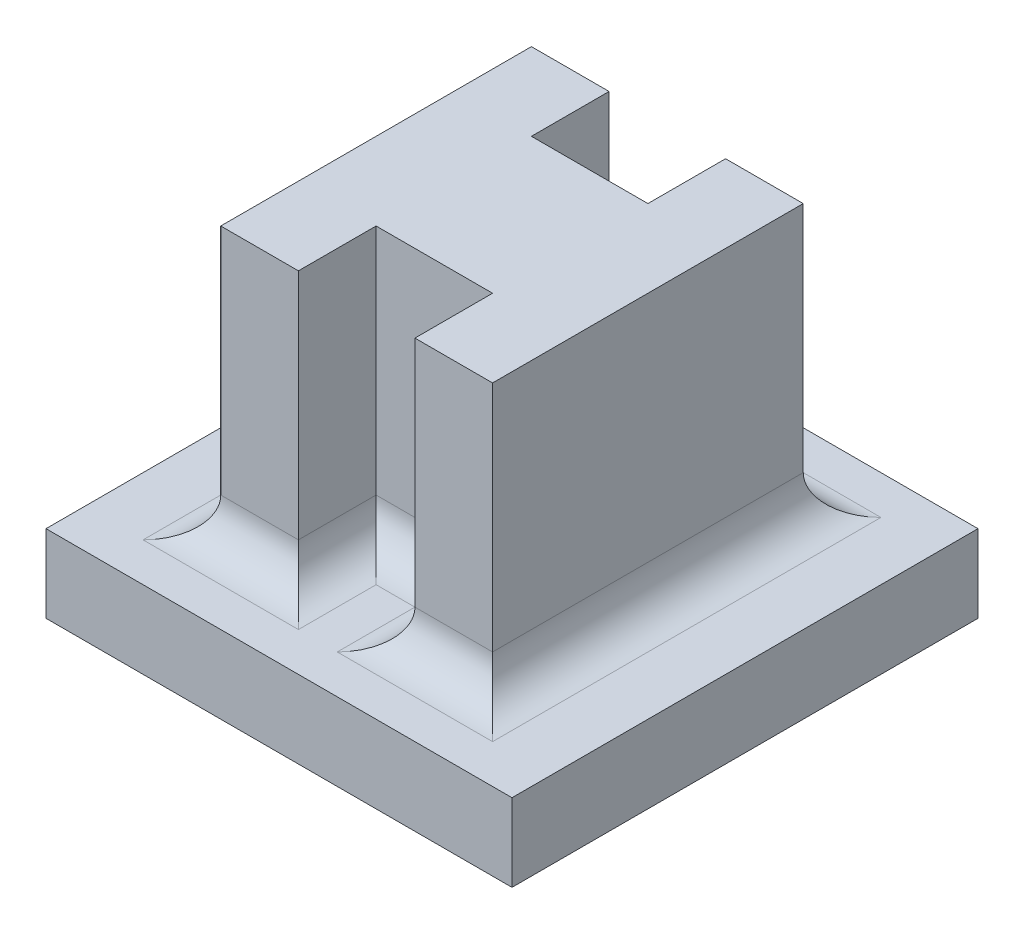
SolidWorks part; units mm, degrees
ref_plane "Front Plane" through (0, 0, 0) normal (0, 0, 1) x (1, 0, 0)
ref_plane "Top Plane" through (0, 0, 0) normal (0, 1, 0) x (1, 0, 0)
ref_plane "Right Plane" through (0, 0, 0) normal (1, 0, 0) x (0, 0, -1)
sketch "Sketch1" plane through (0, 0, 0) normal (0, 1, 0) x (1, 0, 0)
  line L0 (-30, 30) -> (30, -30) construction
  line L1 (-30, 30) -> (30, 30)
  line L2 (-30, 30) -> (-30, -30)
  line L3 (-30, -30) -> (30, -30)
  line L4 (30, 30) -> (30, -30)
  dimension "D1" = 60
  dimension "D2" = 60
extrude "Extrude1" add sketch "Sketch1" along normal blind 10
sketch "Sketch2" plane through (0, 10, 0) normal (0, 1, 0) x (-1, 0, 0)
  line L0 (30, 0) -> (-30, 0) construction
  line L1 (30, -30) -> (30, 30) construction
  line L2 (-30, 30) -> (-30, -30) construction
  line L3 (17.5, 20) -> (17.5, -20)
  line L4 (17.5, -20) -> (7.5, -20)
  line L5 (17.5, 20) -> (7.5, 20)
  line L6 (7.5, -20) -> (7.5, -10)
  line L7 (7.5, 20) -> (7.5, 10)
  line L8 (7.5, -10) -> (-7.5, -10)
  line L9 (7.5, 10) -> (-7.5, 10)
  line L10 (-7.5, -10) -> (-7.5, -20)
  line L11 (-7.5, 10) -> (-7.5, 20)
  line L12 (-7.5, -20) -> (-17.5, -20)
  line L13 (-7.5, 20) -> (-17.5, 20)
  line L14 (-17.5, -20) -> (-17.5, 20)
  line L15 (0, 0) -> (0, -10) construction
  line L16 (0, 0) -> (0, 10) construction
  point P9 (17.5, 0)
  point P19 (-17.5, 0)
  dimension "D1" = 40
  dimension "D2" = 10
  dimension "D3" = 15
  dimension "D4" = 10
extrude "Extrude2" add sketch "Sketch2" along normal blind 35
fillet "Fillet1" radius 5 12 edges at (7.5, 10, 15) (12.5, 10, 20) (17.5, 10, 0) (12.5, 10, -20) (7.5, 10, -15) (0, 10, -10) (-7.5, 10, -15) (-12.5, 10, -20) (-17.5, 10, 0) (-12.5, 10, 20) (-7.5, 10, 15) (0, 10, 10)
